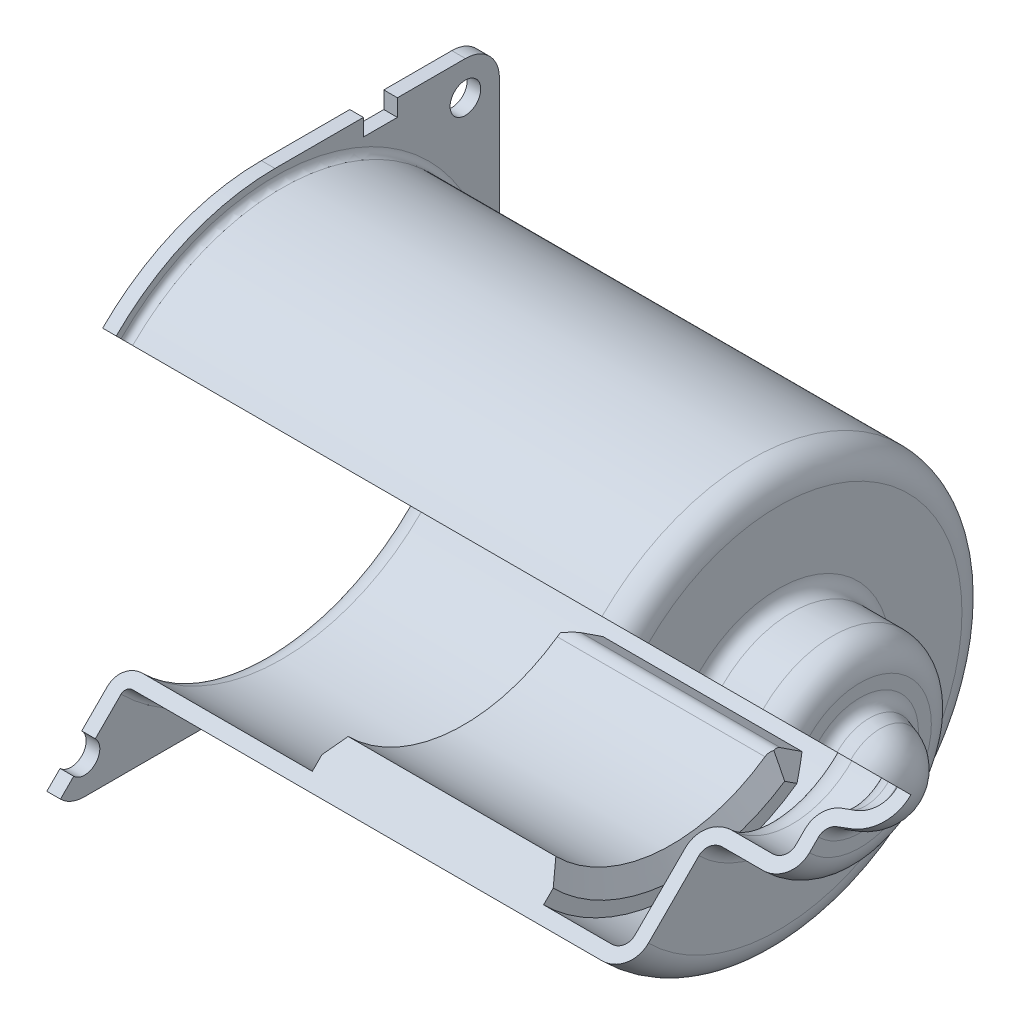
SolidWorks part; units mm, degrees
ref_plane "Plane1" through (0, 0, 0) normal (0, 0, 1) x (1, 0, 0)
ref_plane "Plane2" through (0, 0, 0) normal (0, 1, 0) x (1, 0, 0)
ref_plane "Plane3" through (0, 0, 0) normal (1, 0, 0) x (0, 0, -1)
sketch "Esquisse1" plane through (0, 0, 0) normal (0, 0, 1) x (1, 0, 0)
  line L0 (0, 29) -> (0, 31)
  line L1 (0, 31) -> (72, 31)
  line L2 (76, 27) -> (76, 16.5)
  line L3 (88.8056, 4.7757) -> (90.3436, 4.2945)
  line L4 (93.4998, 0) -> (95.5, 0) construction
  line L5 (0, 29) -> (72, 29)
  line L6 (74, 27) -> (74, 16.5)
  line L7 (78, 14.5) -> (84, 14.5)
  line L8 (78, 12.5) -> (84, 12.5)
  line L9 (88, 10.5) -> (88, 8.61)
  line L10 (86, 10.5) -> (86, 8.5932)
  line L11 (91, 6.1847) -> (89.3846, 6.707)
  line L12 (93.4998, 0) -> (95.5, 0)
  arc A0 (93.4998, 0) -> (90.3436, 4.2945) centre (89, 0) ccw
  arc A2 (95.5, 0) -> (91, 6.1847) centre (89, 0) ccw
  arc A3 (88, 8.61) -> (89.3846, 6.707) centre (90, 8.61) ccw
  arc A4 (76, 16.5) -> (78, 14.5) centre (78, 16.5) ccw
  arc A5 (72, 29) -> (74, 27) centre (72, 27) cw
  arc A6 (76, 27) -> (72, 31) centre (72, 27) ccw
  arc A7 (74, 16.5) -> (78, 12.5) centre (78, 16.5) ccw
  arc A8 (88, 10.5) -> (84, 14.5) centre (84, 10.5) ccw
  arc A9 (86, 8.5932) -> (88.8056, 4.7757) centre (90, 8.5932) ccw
  arc A10 (86, 10.5) -> (84, 12.5) centre (84, 10.5) ccw
  dimension "D1" = 2
  dimension "D4" = 4
  dimension "D5" = 2
  dimension "D2" = 29
  dimension "D3" = 31
  dimension "D6" = 76
  dimension "D7" = 88
  dimension "D8" = 89
  dimension "D9" = 2
  dimension "D10" = 2
  dimension "D11" = 2
revolve "Base-Révolution" add sketch "Esquisse1" angle 360 about L4
sketch "Esquisse2" plane through (0, 0, 0) normal (-1, 0, 0) x (0, 0, 1)
  line L0 (0, 33) -> (-13, 33)
  line L1 (-33, 28) -> (-33, 0)
  line L3 (28, -33) -> (0, -33)
  line L4 (33, 0) -> (33, -28)
  line L6 (-18, 33) -> (-18, 30.5)
  line L7 (-13, 30.5) -> (-18, 30.5)
  line L8 (-13, 30.5) -> (-13, 33)
  line L9 (-18, 33) -> (-28, 33)
  circle A0 centre (0, 0) radius 30
  arc A1 (-33, 0) -> (0, -33) centre (0, 0) ccw
  arc A2 (-28, 33) -> (-33, 28) centre (-28, 28) ccw
  circle A3 centre (-28, 28) radius 2.25
  circle A4 centre (28, -28) radius 2.25
  arc A5 (33, -28) -> (28, -33) centre (28, -28) cw
  arc A6 (33, 0) -> (0, 33) centre (0, 0) ccw
  dimension "D1" = 5
  dimension "D2" = 4.5
extrude "Boss.-Extru.1" add sketch "Esquisse2" against normal blind 2
fillet "Congé2" radius 1
fillet "Congé3" radius 3
ref_plane "Plan4" through (28, 0, 0) normal (-1, 0, 0) x (0, 0, 1)
sketch "Esquisse3" plane through (28, 0, 0) normal (-1, 0, 0) x (0, 0, 1)
  line L0 (-14.8511, -18.8533) -> (-20.0891, -22.2807)
  line L1 (28.4605, 9.4868) -> (23.2225, 6.0594)
  line L2 (20.0891, 22.2807) -> (14.8511, 18.8533)
  line L3 (-23.2225, -6.0594) -> (-28.4605, -9.4868)
  line L4 (0, 0) -> (47.704, 31.2142) construction
  arc A0 (20.0891, 22.2807) -> (-28.4605, -9.4868) centre (0, 0) ccw
  arc A1 (14.8511, 18.8533) -> (-23.2225, -6.0594) centre (0, 0) ccw
  arc A2 (23.2225, 6.0594) -> (-14.8511, -18.8533) centre (0, 0) cw
  arc A3 (28.4605, 9.4868) -> (-20.0891, -22.2807) centre (0, 0) cw
extrude "Boss.-Extru.2" add sketch "Esquisse3" against normal blind 34
chamfer "Chanfrein2" distance 3 angle 30
fillet "Congé4" radius 2
chamfer "Chanfrein3" distance 3 angle 30
sketch "Esquisse4" plane through (0, 0, 0) normal (-1, 0, 0) x (0, 0, 1)
  line L0 (0, 0) -> (34, -34)
  line L1 (0, 0) -> (34, -34) construction
  line L2 (0, 0) -> (37.7905, 37.7905) construction
  line L3 (0, 0) -> (34, 34)
  line L4 (34, 34) -> (34, -34)
extrude "Enlèv. mat.-Extru.1" cut sketch "Esquisse4" against normal through all
